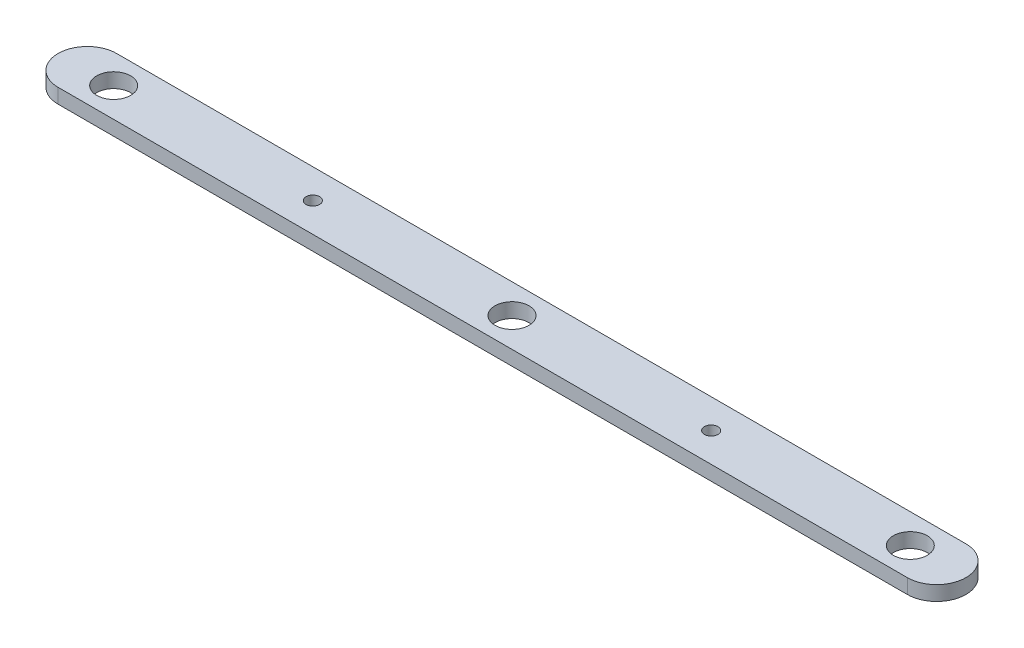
SolidWorks part; units mm, degrees
ref_plane "Front" through (0, 0, 0) normal (0, 0, 1) x (1, 0, 0)
ref_plane "Top" through (0, 0, 0) normal (0, 1, 0) x (1, 0, 0)
ref_plane "Right" through (0, 0, 0) normal (1, 0, 0) x (0, 0, -1)
sketch "Sketch1" plane through (0, 0, 0) normal (0, 1, 0) x (1, 0, 0)
  line L0 (0, 0) -> (184.15, 0) construction
  line L1 (0, 6.35) -> (184.15, 6.35)
  line L2 (0, -6.35) -> (184.15, -6.35)
  arc A0 (0, 6.35) -> (0, -6.35) centre (0, 0) ccw
  arc A1 (184.15, -6.35) -> (184.15, 6.35) centre (184.15, 0) ccw
  circle A2 centre (92.075, 0) radius 3.683
  circle A3 centre (5.715, 0) radius 3.683
  circle A4 centre (178.435, 0) radius 3.683
  point P3 (92.075, 0)
  dimension "D2" = 7.366
  dimension "D5" = 6.35
  dimension "D1" = 184.15
  dimension "D3" = 86.36
  dimension "D4" = 86.36
extrude "Boss-Extrude1" add sketch "Sketch1" along normal blind 3.175
hole_wizard "#4 Clearance Hole1" positions "Sketch3" profile "Sketch2" hole size "#4" standard "ANSI Inch"
sketch "Sketch3" plane through (0, 3.175, 0) normal (0, 1, 0) x (1, 0, 0)
  line L0 (0, 0) -> (184.15, 0) construction
  line L1 (5.715, 19.6294) -> (92.075, 19.6294) construction
  line L2 (92.075, 19.6294) -> (178.435, 19.6294) construction
  point P0 (48.895, 0)
  point P3 (135.255, 0)
  point P23 (48.895, 19.6294)
  point P30 (135.255, 19.6294)
sketch "Sketch2" plane through (48.895, 3.175, 0) normal (1, 0, 0) x (0, 0, 1)
  line L0 (0, 0) -> (0, 3.175)
  line L1 (0, 3.175) -> (1.4732, 3.175)
  line L2 (1.4732, 3.175) -> (1.4732, 0)
  line L5 (1.4732, 0) -> (0, 0)
  line L11 (0, -6.35) -> (0, 107.95) construction
  dimension "Thru Hole Dia." = 2.9464
  dimension "Thru Hole Depth" = 3.175
